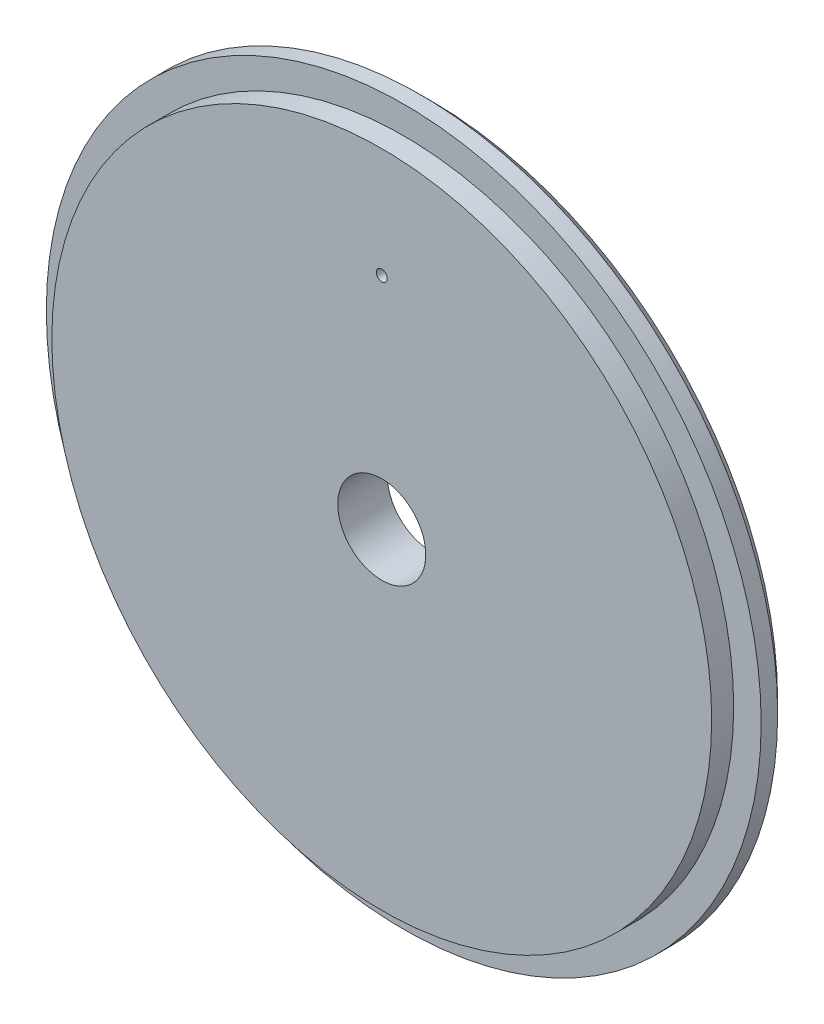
SolidWorks part; units mm, degrees
ref_plane "Front" through (0, 0, 0) normal (0, 0, 1) x (1, 0, 0)
ref_plane "Top" through (0, 0, 0) normal (0, 1, 0) x (1, 0, 0)
ref_plane "Right" through (0, 0, 0) normal (1, 0, 0) x (0, 0, -1)
sketch "Esquisse1" plane through (0, 0, 0) normal (0, 0, 1) x (1, 0, 0)
  circle A0 centre (0, 0) radius 32.5
  dimension "D1" = 65
extrude "Boss.-Extru.1" add sketch "Esquisse1" along normal blind 2.5
sketch "Esquisse2" plane through (0, 0, 2.5) normal (0, 0, 1) x (1, 0, 0)
  circle A0 centre (0, 0) radius 30
  dimension "D1" = 60
extrude "Boss.-Extru.2" add sketch "Esquisse2" along normal blind 2
hole_wizard "Diamètre du perçage Ø0.15 (0.15)1" positions "Esquisse4" profile "Esquisse3" hole size "Ø0.15" standard "Ansi Metric"
sketch "Esquisse4" plane through (0, 0, 0) normal (0, 0, -1) x (-1, 0, 0)
  point P0 (0, 0)
sketch "Esquisse3" plane through (0, 0, 0) normal (1, 0, 0) x (0, 1, 0)
  line L0 (0, 0) -> (0, 4.5)
  line L1 (0, 4.5) -> (4, 4.5)
  line L2 (4, 4.5) -> (4, 0)
  line L5 (4, 0) -> (0, 0)
  line L11 (0, -6.35) -> (0, 107.95) construction
  dimension "Diamètre du perçage jusqu'au prochain" = 8
  dimension "Profondeur du perçage jusqu'au prochain" = 4.5
hole_wizard "Diamètre du perçage Ø0.15 (0.15)2" positions "Esquisse6" profile "Esquisse5" hole size "Ø0.15" standard "Ansi Metric"
sketch "Esquisse6" plane through (0, 0, 0) normal (0, 0, -1) x (-1, 0, 0)
  circle A0 centre (0, 0) radius 4 construction
  point P0 (0, 20)
  dimension "D1" = 20
sketch "Esquisse5" plane through (0, 20, 0) normal (1, 0, 0) x (0, 1, 0)
  line L0 (0, 0) -> (0, 4.5)
  line L1 (0, 4.5) -> (0.5, 4.5)
  line L2 (0.5, 4.5) -> (0.5, 0)
  line L5 (0.5, 0) -> (0, 0)
  line L11 (0, -6.35) -> (0, 107.95) construction
  dimension "Diamètre du perçage jusqu'au prochain" = 1
  dimension "Profondeur du perçage jusqu'au prochain" = 4.5
chamfer "Chanfrein1" distance 1 angle 45 1 edges at (32.5, 0, 0)
